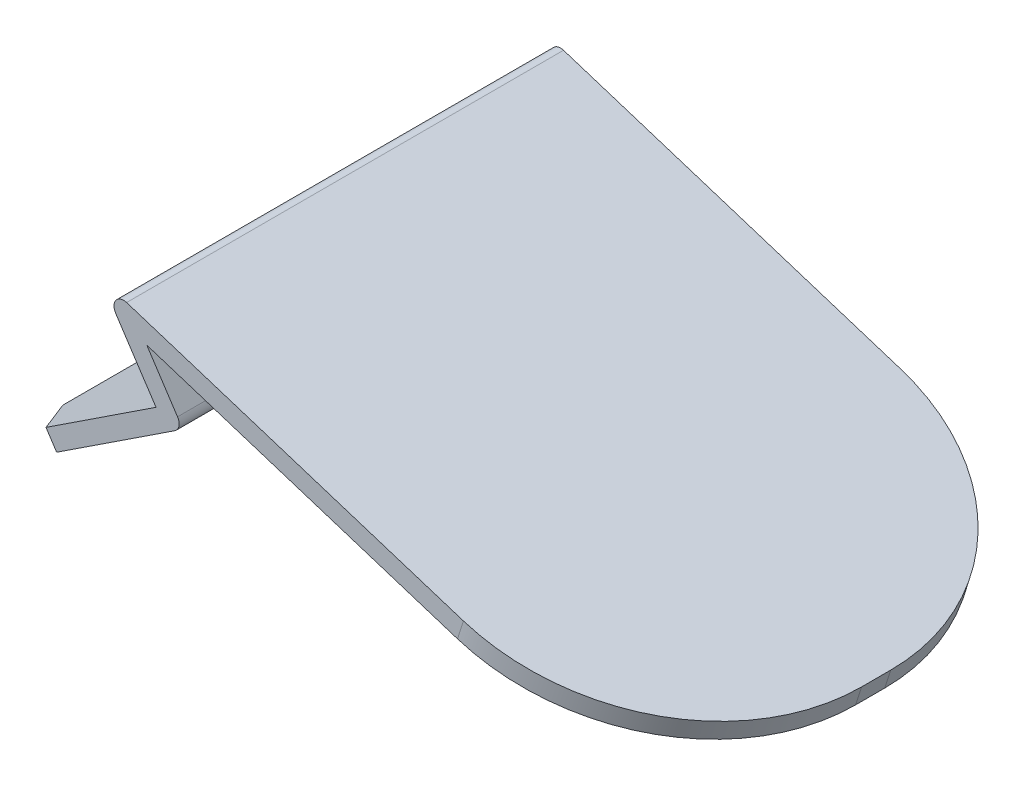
SolidWorks part; units mm, degrees
ref_plane "Front Plane" through (0, 0, 0) normal (0, 0, 1) x (1, 0, 0)
ref_plane "Top Plane" through (0, 0, 0) normal (0, 1, 0) x (1, 0, 0)
ref_plane "Right Plane" through (0, 0, 0) normal (1, 0, 0) x (0, 0, -1)
sketch "Sketch1" plane through (0, 0, 0) normal (0, 0, 1) x (1, 0, 0)
  line L0 (-33.1335, -9.1462) -> (-18.5405, 0.4528)
  line L1 (-18.5405, 0.4528) -> (-24.2589, 9.1462)
  line L2 (33.1335, -9.1462) -> (-24.2589, 9.1462)
  line L3 (-32.0344, -10.8171) -> (-15.7705, -0.119)
  line L4 (-15.7705, -0.119) -> (-19.4829, 5.5249)
  line L5 (32.5262, -11.0518) -> (-19.4829, 5.5249)
  line L6 (-32.0344, -10.8171) -> (-33.1335, -9.1462)
  line L7 (33.1335, -9.1462) -> (32.5262, -11.0518)
  dimension "D1" = 2
extrude "Boss-Extrude1" add sketch "Sketch1" along normal blind 45
fillet "Fillet1" radius 1 2 edges at (-15.7705, -0.119, 22.5) (-24.2589, 9.1462, 22.5)
chamfer "Chamfer1" distance 5 angle 38 2 edges at (-32.584, -9.9817, 0) (-32.584, -9.9817, 45)
fillet "Fillet2" radius 21 2 edges at (32.8299, -10.099, 0) (32.8299, -10.099, 45)
